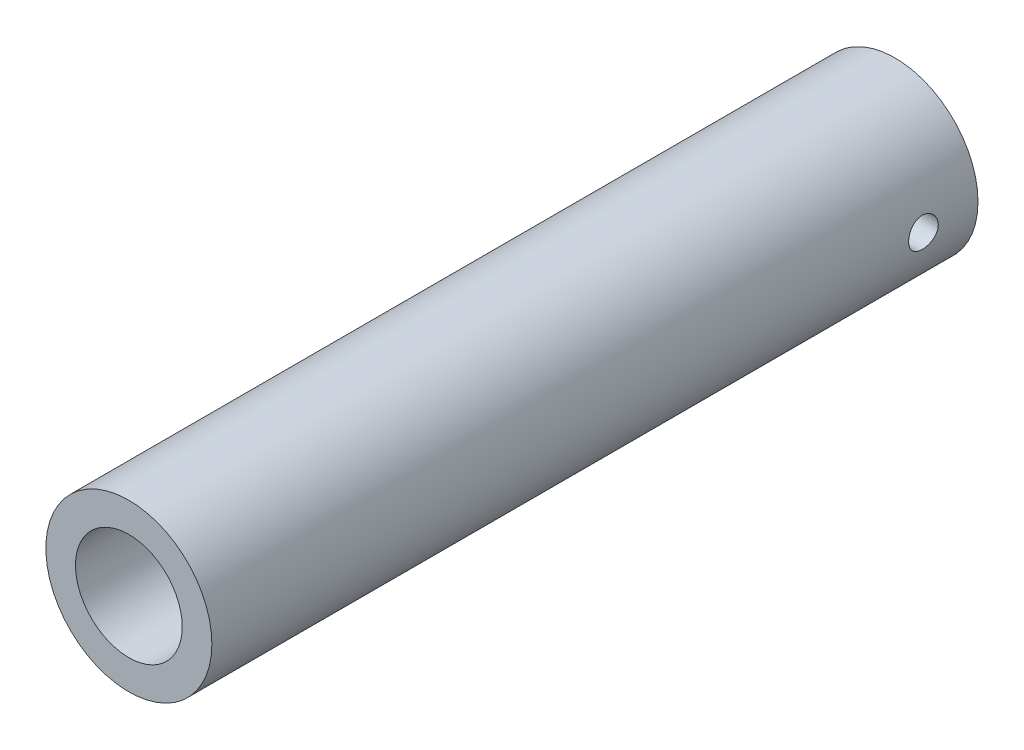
SolidWorks part; units mm, degrees
ref_plane "Plan de face" through (0, 0, 0) normal (0, 0, 1) x (1, 0, 0)
ref_plane "Plan de dessus" through (0, 0, 0) normal (0, 1, 0) x (1, 0, 0)
ref_plane "Plan de droite" through (0, 0, 0) normal (1, 0, 0) x (0, 0, -1)
sketch "Esquisse1" plane through (0, 0, 0) normal (0, 0, 1) x (1, 0, 0)
  circle A0 centre (0, 0) radius 9
  circle A1 centre (0, 0) radius 14
  dimension "D1" = 28
  dimension "D2" = 18
extrude "Extrusion1" add sketch "Esquisse1" along normal blind 129.2
sketch "Esquisse2" plane through (0, 0, 0) normal (1, 0, 0) x (0, 0, -1)
  line L0 (0, -14) -> (0, 14) construction
  circle A0 centre (-9.2, 0) radius 2.5
  dimension "D1" = 5
  dimension "D2" = 9.2
extrude "Enlèv. mat.-Extru.1" cut sketch "Esquisse2" against normal mid plane 30
